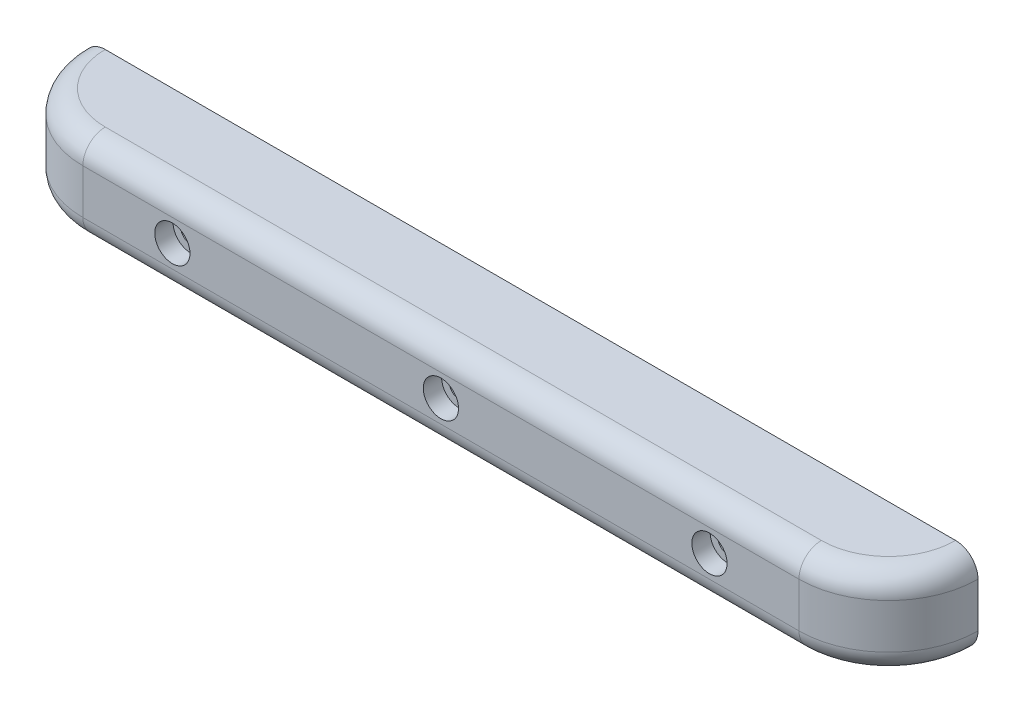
SolidWorks part; units mm, degrees
ref_plane "Front Plane" through (0, 0, 0) normal (0, 0, 1) x (1, 0, 0)
ref_plane "Top Plane" through (0, 0, 0) normal (0, 1, 0) x (1, 0, 0)
ref_plane "Right Plane" through (0, 0, 0) normal (1, 0, 0) x (0, 0, -1)
sketch "Sketch1" plane through (0, 0, 0) normal (0, 0, 1) x (1, 0, 0)
  line L1 (-127, -12.7) -> (127, -12.7)
  line L2 (-127, -12.7) -> (-127, 12.7)
  line L3 (-127, 12.7) -> (127, 12.7)
  line L4 (127, -12.7) -> (127, 12.7)
  point P4 (0, 12.7)
  point P5 (127, 0)
  dimension "D1" = 25.4
  dimension "D2" = 254
extrude "Extrude1" add sketch "Sketch1" along normal blind 25.4
sketch "Sketch4" plane through (0, 12.7, 0) normal (0, 1, 0) x (-1, 0, 0)
  line L0 (-127, 25.4) -> (127, 25.4) construction
  line L1 (-127, 0) -> (-127, 25.4)
  line L2 (-127, 25.4) -> (-101.6, 25.4)
  line L3 (-127, 0) -> (127, 0) construction
  arc A0 (-127, 0) -> (-101.6, 25.4) centre (-101.6, 0) cw
extrude "Cut-Extrude2" cut sketch "Sketch4" against normal through all
mirror "Mirror1" about plane through (0, 0, 0) normal (1, 0, 0) of "Cut-Extrude2"
fillet "Fillet1" radius 6.35 8 edges at (-101.6, 0, 25.4) (101.6, 0, 25.4) (0, -12.7, 25.4) (0, 12.7, 25.4) (-119.5605, 12.7, 17.9605) (119.5605, 12.7, 17.9605) (-119.5605, -12.7, 17.9605) (119.5605, -12.7, 17.9605)
hole_wizard "CBORE for M5 SHCS1" positions "Sketch3" profile "Sketch2" counterbore size "M5" standard "Ansi Metric"
sketch "Sketch3" plane through (0, 0, 25.4) normal (0, 0, 1) x (1, 0, 0)
  line L0 (0, -53.1141) -> (0, 80.1101) construction
  point P0 (76.2, 0)
  point P1 (0, 0)
  point P5 (-76.2, 0)
  dimension "D1" = 152.4
sketch "Sketch2" plane through (76.2, 0, 25.4) normal (1, 0, 0) x (0, -1, 0)
  line L0 (0, 0) -> (0, 25.4)
  line L1 (0, 25.4) -> (2.85, 25.4)
  line L3 (2.85, 25.4) -> (2.85, 5.2)
  line L4 (2.85, 5.2) -> (5, 5.2)
  line L5 (5, 5.2) -> (5, 0)
  line L7 (5, 0) -> (0, 0)
  line L11 (0, -6.35) -> (0, 107.95) construction
  dimension "Thru Hole Dia." = 5.7
  dimension "Thru Hole Depth" = 25.4
  dimension "C'Bore Dia." = 10
  dimension "C'Bore Depth" = 5.2
